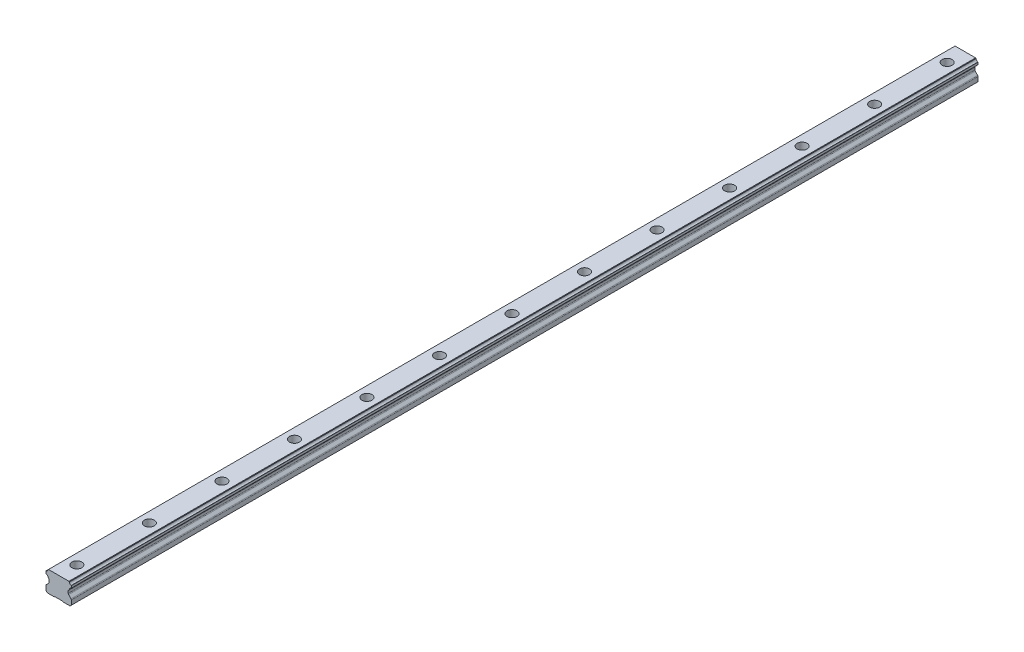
SolidWorks part; units mm, degrees
ref_plane "Front Plane" through (0, 0, 0) normal (0, 0, 1) x (1, 0, 0)
ref_plane "Top Plane" through (0, 0, 0) normal (0, 1, 0) x (1, 0, 0)
ref_plane "Right Plane" through (0, 0, 0) normal (1, 0, 0) x (0, 0, -1)
sketch "Sketch2" plane through (0, 0, 0) normal (0, 0, 1) x (1, 0, 0)
  line L0 (11.8905, 11.2473) -> (11.4323, 11.7055)
  line L1 (11.4323, 11.7055) -> (-11.1677, 11.7055)
  line L2 (-11.1677, 11.7055) -> (-11.6259, 11.2473)
  line L3 (-13.8677, 8.8575) -> (-13.8677, 6.5535)
  line L4 (-11.6259, 4.1637) -> (-10.8071, 3.3448)
  line L5 (-10.3677, 2.2842) -> (-10.3677, -0.1733)
  line L6 (-10.8071, -1.2338) -> (-13.4284, -3.8552)
  line L7 (-13.8677, -4.9158) -> (-13.8677, -9.7945)
  line L8 (-13.8677, -9.7945) -> (-12.3677, -11.2945)
  line L9 (-12.3677, -11.2945) -> (-4.8677, -11.2945)
  line L10 (-4.8677, -11.2945) -> (-4.3677, -10.7945)
  line L11 (-4.3677, -10.7945) -> (4.6323, -10.7945)
  line L12 (4.6323, -10.7945) -> (5.1323, -11.2945)
  line L13 (5.1323, -11.2945) -> (12.6323, -11.2945)
  line L14 (12.6323, -11.2945) -> (14.1323, -9.7945)
  line L15 (14.1323, -9.7945) -> (14.1323, -4.9157)
  line L16 (13.6929, -3.8552) -> (11.0716, -1.2338)
  line L17 (10.6323, -0.1732) -> (10.6323, 2.2843)
  line L18 (11.0716, 3.3448) -> (11.8905, 4.1637)
  line L19 (14.1323, 6.5535) -> (14.1323, 8.8575)
  arc A0 (11.9104, 11.2253) -> (11.8905, 11.2473) centre (11.6783, 11.0352) ccw
  arc A1 (-11.6259, 11.2473) -> (-11.6459, 11.2253) centre (-11.4138, 11.0352) ccw
  arc A2 (-13.7604, 9.0875) -> (-11.6459, 11.2253) centre (-14.1232, 11.561) ccw
  arc A3 (-13.7604, 9.0875) -> (-13.8677, 8.8575) centre (-13.5677, 8.8575) ccw
  arc A4 (-13.8677, 6.5535) -> (-13.7604, 6.3235) centre (-13.5677, 6.5535) ccw
  arc A5 (-11.6459, 4.1857) -> (-13.7604, 6.3235) centre (-14.1232, 3.85) ccw
  arc A6 (-11.6459, 4.1857) -> (-11.6259, 4.1637) centre (-11.4138, 4.3758) ccw
  arc A7 (-10.3677, 2.2842) -> (-10.8071, 3.3448) centre (-11.8677, 2.2842) ccw
  arc A8 (-10.8071, -1.2338) -> (-10.3677, -0.1733) centre (-11.8677, -0.1732) ccw
  arc A9 (-13.4284, -3.8552) -> (-13.8677, -4.9158) centre (-12.3677, -4.9158) ccw
  arc A10 (14.1323, -4.9157) -> (13.6929, -3.8552) centre (12.6323, -4.9158) ccw
  arc A11 (10.6323, -0.1732) -> (11.0716, -1.2338) centre (12.1323, -0.1732) ccw
  arc A12 (11.0716, 3.3448) -> (10.6323, 2.2843) centre (12.1323, 2.2842) ccw
  arc A13 (11.8905, 4.1637) -> (11.9104, 4.1857) centre (11.6783, 4.3758) ccw
  arc A14 (14.0249, 6.3235) -> (11.9104, 4.1857) centre (14.3878, 3.85) ccw
  arc A15 (14.0249, 6.3235) -> (14.1323, 6.5535) centre (13.8323, 6.5535) ccw
  arc A16 (14.1323, 8.8575) -> (14.0249, 9.0875) centre (13.8323, 8.8575) ccw
  arc A17 (11.9104, 11.2253) -> (14.0249, 9.0875) centre (14.3878, 11.561) ccw
extrude "Boss-Extrude1" add sketch "Sketch2" along normal blind 1000
sketch "Sketch3" plane through (0, 11.7055, 0) normal (0, 1, 0) x (1, 0, 0)
  line L0 (14.1323, -1000) -> (14.1323, 0) construction
  line L3 (11.4323, 0) -> (-11.1677, 0) construction
  point P0 (0.1323, -20)
  dimension "D1" = 14
  dimension "D2" = 20
hole_wizard "CBORE for M16 Hex Head Bolt1" positions "Sketch3" profile "Sketch4" counterbore size "M16" standard "DIN"
sketch "Sketch4" plane through (0.1323, 11.7055, 20) normal (1, 0, 0) x (0, 0, 1)
  line L0 (0, 0) -> (0, 23)
  line L1 (0, 23) -> (3.5, 23)
  line L3 (3.5, 23) -> (3.5, 9)
  line L4 (3.5, 9) -> (5.5, 9)
  line L5 (5.5, 9) -> (5.5, 0)
  line L7 (5.5, 0) -> (0, 0)
  line L11 (0, -6.35) -> (0, 107.95) construction
  dimension "Thru Hole Dia." = 7
  dimension "Thru Hole Depth" = 23
  dimension "C'Bore Dia." = 11
  dimension "C'Bore Depth" = 9
other "Fill Pattern1" parameters "D5"=0, "D6"=0, "D1"=80, "D2"=60, "D3"=0, "D9"=13, "D7"=13, "D8"=2
